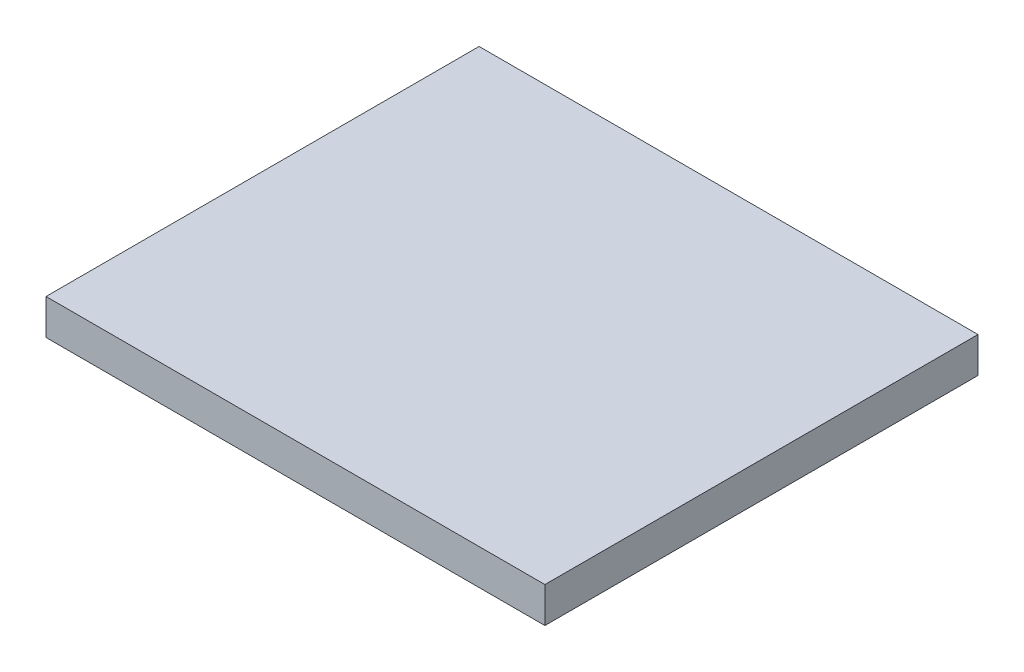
SolidWorks part; units mm, degrees
ref_plane "Front Plane" through (0, 0, 0) normal (0, 0, 1) x (1, 0, 0)
ref_plane "Top Plane" through (0, 0, 0) normal (0, 1, 0) x (1, 0, 0)
ref_plane "Right Plane" through (0, 0, 0) normal (1, 0, 0) x (0, 0, -1)
sketch "Skizze1" plane through (0, 0, 0) normal (0, 1, 0) x (1, 0, 0)
  line L1 (28.1447, -30.8829) -> (-118.1574, -30.8829)
  line L2 (28.1447, -30.8829) -> (28.1447, 96.1171)
  line L3 (28.1447, 96.1171) -> (-118.1574, 96.1171)
  line L4 (-118.1574, -30.8829) -> (-118.1574, 96.1171)
  dimension "D1" = 0
extrude "Linear austragen1" add sketch "Skizze1" along normal blind 10.414
